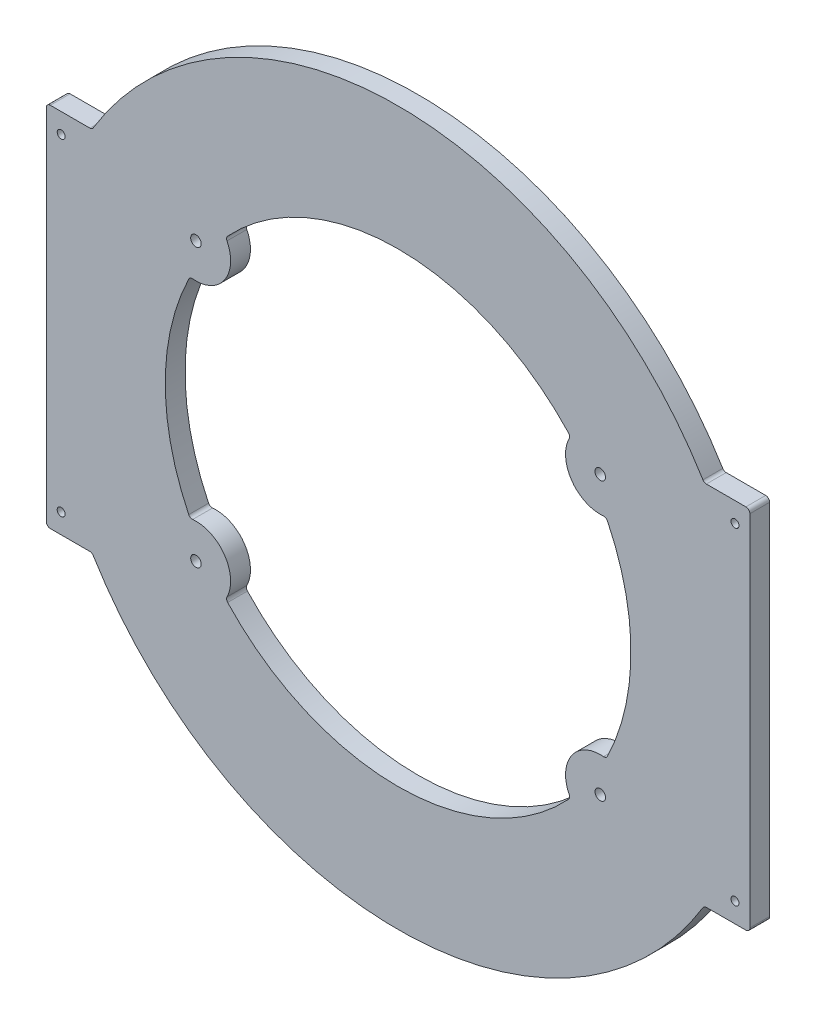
SolidWorks part; units mm, degrees
ref_plane "Front Plane" through (0, 0, 0) normal (0, 0, 1) x (1, 0, 0)
ref_plane "Top Plane" through (0, 0, 0) normal (0, 1, 0) x (1, 0, 0)
ref_plane "Right Plane" through (0, 0, 0) normal (1, 0, 0) x (0, 0, -1)
sketch "Sketch1" plane through (0, 0, 0) normal (0, 0, 1) x (1, 0, 0)
  circle A0 centre (0, 0) radius 149.225
  circle A1 centre (0, 0) radius 228.6
  dimension "D1" = 457.2
  dimension "D2" = 298.45
extrude "Boss-Extrude1" add sketch "Sketch1" along normal blind 12.7
hole_wizard "1/4 Clearance Hole1" positions "Sketch3" profile "Sketch2" hole size "1/4" standard "ANSI Inch"
sketch "Sketch3" plane through (0, 0, 12.7) normal (0, 0, 1) x (1, 0, 0)
  point P0 (-129.54, 88.9)
  point P3 (-129.54, -88.9)
  point P6 (129.54, -88.9)
  point P9 (129.54, 88.9)
sketch "Sketch2" plane through (-129.54, 88.9, 12.7) normal (1, 0, 0) x (0, -1, 0)
  line L0 (0, 0) -> (0, 12.7)
  line L1 (0, 12.7) -> (3.3782, 12.7)
  line L2 (3.3782, 12.7) -> (3.3782, 0)
  line L5 (3.3782, 0) -> (0, 0)
  line L11 (0, -6.35) -> (0, 107.95) construction
  dimension "Thru Hole Dia." = 6.7564
  dimension "Thru Hole Depth" = 12.7
sketch "Sketch4" plane through (0, 0, 12.7) normal (0, 0, 1) x (1, 0, 0)
  circle A0 centre (-129.54, 88.9) radius 22.225
  circle A1 centre (-129.54, 88.9) radius 3.3782 construction
  circle A2 centre (-129.54, 88.9) radius 3.3782
  circle A3 centre (-129.54, -88.9) radius 22.225
  circle A4 centre (-129.54, -88.9) radius 3.3782 construction
  circle A5 centre (-129.54, -88.9) radius 3.3782
  circle A6 centre (129.54, -88.9) radius 22.225
  circle A7 centre (129.54, 88.9) radius 22.225
  circle A8 centre (129.54, 88.9) radius 3.3782 construction
  circle A9 centre (129.54, 88.9) radius 3.3782
  circle A10 centre (129.54, -88.9) radius 3.3782 construction
  circle A11 centre (129.54, -88.9) radius 3.3782
  dimension "D1" = 44.45
extrude "Boss-Extrude2" add sketch "Sketch4" against normal blind 12.7
sketch "Sketch5" plane through (0, 0, 12.7) normal (0, 0, 1) x (1, 0, 0)
  line L1 (225.425, 117.475) -> (166.009, 117.475)
  line L2 (225.425, 117.475) -> (225.425, -117.475)
  line L3 (225.425, -117.475) -> (166.009, -117.475)
  line L4 (166.009, 117.475) -> (166.009, -117.475)
extrude "Boss-Extrude3" add sketch "Sketch5" against normal up to surface (12.7 mm away)
sketch "Sketch6" plane through (0, 0, 12.7) normal (0, 0, 1) x (1, 0, 0)
  line L1 (225.425, 117.475) -> (270.3289, 117.475)
  line L2 (225.425, 117.475) -> (225.425, -117.523)
  line L3 (225.425, -117.523) -> (270.3289, -117.523)
  line L4 (270.3289, 117.475) -> (270.3289, -117.523)
extrude "Cut-Extrude1" cut sketch "Sketch6" against normal through all
mirror "Mirror1" about plane through (0, 0, 0) normal (1, 0, 0) of "Boss-Extrude3", "Cut-Extrude1"
fillet "Fillet1" radius 2.54 16 edges at (-133.3374, -67.0018, 6.35) (-110.4727, -100.3189, 6.35) (-110.4727, 100.3189, 6.35) (-133.3374, 67.0018, 6.35) (133.3374, 67.0018, 6.35) (110.4727, 100.3189, 6.35) (110.4727, -100.3189, 6.35) (133.3374, -67.0018, 6.35) (196.1061, -117.475, 6.35) (196.1061, 117.475, 6.35) (225.425, 117.475, 6.35) (225.425, -117.475, 6.35) (-196.1061, 117.475, 6.35) (-225.425, 117.475, 6.35) (-196.1061, -117.475, 6.35) (-225.425, -117.475, 6.35)
hole_wizard "#10 Clearance Hole1" positions "Sketch8" profile "Sketch7" hole size "#10" standard "ANSI Inch"
sketch "Sketch8" plane through (0, 0, 12.7) normal (0, 0, 1) x (1, 0, 0)
  point P0 (215.9, 104.775)
  point P3 (215.9, -104.775)
  point P6 (-215.9, -104.775)
  point P9 (-215.9, 104.775)
sketch "Sketch7" plane through (215.9, 104.775, 12.7) normal (1, 0, 0) x (0, -1, 0)
  line L0 (0, 0) -> (0, 12.7)
  line L1 (0, 12.7) -> (2.5527, 12.7)
  line L2 (2.5527, 12.7) -> (2.5527, 0)
  line L5 (2.5527, 0) -> (0, 0)
  line L11 (0, -6.35) -> (0, 107.95) construction
  dimension "Thru Hole Dia." = 5.1054
  dimension "Thru Hole Depth" = 12.7
